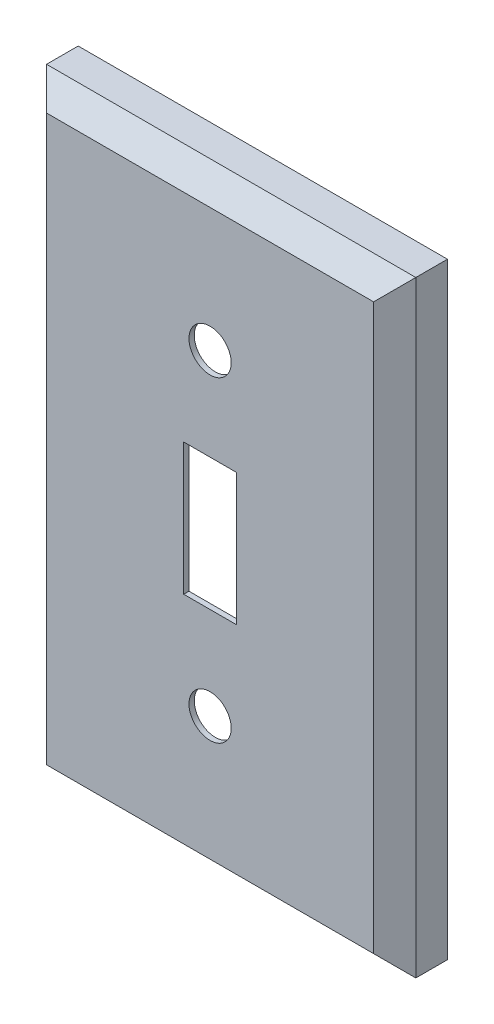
SolidWorks part; units mm, degrees
ref_plane "Front" through (0, 0, 0) normal (0, 0, 1) x (1, 0, 0)
ref_plane "Top" through (0, 0, 0) normal (0, 1, 0) x (1, 0, 0)
ref_plane "Right" through (0, 0, 0) normal (1, 0, 0) x (0, 0, -1)
sketch "Sketch1" plane through (0, 0, 0) normal (0, 0, 1) x (1, 0, 0)
  line L1 (0, 0) -> (70, 0)
  line L2 (0, 0) -> (0, 115)
  line L3 (0, 115) -> (70, 115)
  line L4 (70, 0) -> (70, 115)
  dimension "D1" = 70
  dimension "D2" = 115
extrude "Base-Extrude" add sketch "Sketch1" along normal blind 10
chamfer "Chamfer2" distance 4 angle 45 4 edges at (70, 57.5, 10) (35, 115, 10) (0, 57.5, 10) (35, 0, 10)
shell "Shell1" thickness 1
sketch "Sketch3" plane through (0, 0, 0) normal (0, 0, -1) x (-1, 0, 0)
  line L0 (-70, 0) -> (0, 0) construction
  line L1 (-30, 45) -> (-40, 45)
  line L2 (-30, 45) -> (-30, 70)
  line L3 (-30, 70) -> (-40, 70)
  line L4 (-40, 45) -> (-40, 70)
  line L5 (0, 0) -> (0, 115) construction
  dimension "D1" = 10
  dimension "D2" = 25
  dimension "D3" = 45
  dimension "D4" = 30
extrude "switchhole" cut sketch "Sketch3" against normal through all
sketch "Sketch4" plane through (0, 0, 0) normal (0, 0, -1) x (-1, 0, 0)
  line L0 (0, 0) -> (0, 115) construction
  line L1 (-70, 0) -> (0, 0) construction
  circle A0 centre (-35, 87.5) radius 4
  circle A1 centre (-35, 27.5) radius 4
  dimension "D1" = 8
  dimension "D2" = 60
  dimension "D3" = 35
  dimension "D4" = 27.5
extrude "screwhole" cut sketch "Sketch4" against normal through all
